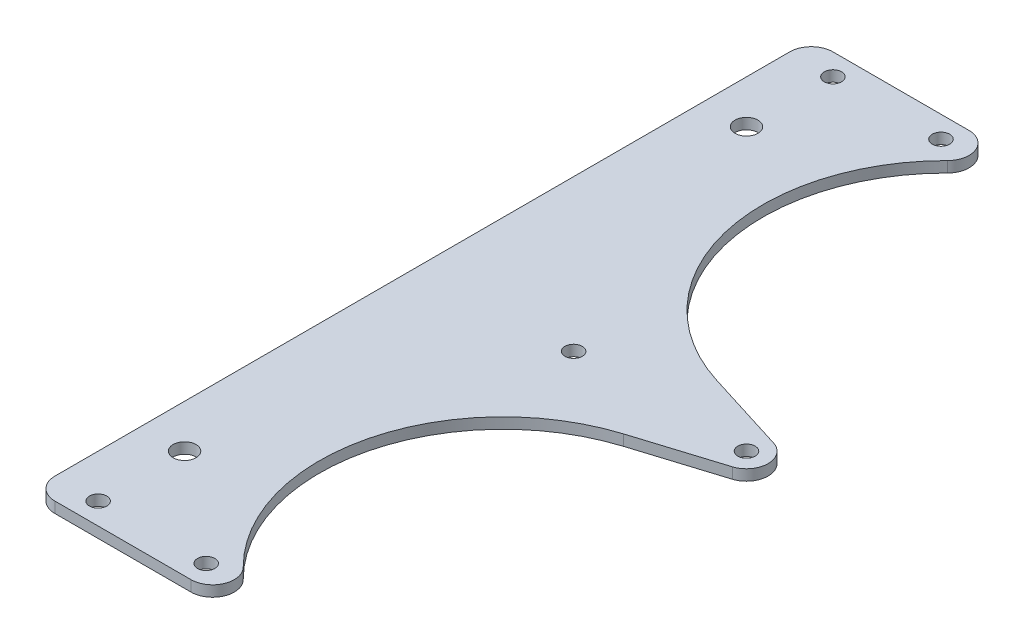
SolidWorks part; units mm, degrees
ref_plane "Front Plane" through (0, 0, 0) normal (0, 0, 1) x (1, 0, 0)
ref_plane "Top Plane" through (0, 0, 0) normal (0, 1, 0) x (1, 0, 0)
ref_plane "Right Plane" through (0, 0, 0) normal (1, 0, 0) x (0, 0, -1)
sketch "Sketch1" plane through (0, 0, 0) normal (0, 1, 0) x (1, 0, 0)
  line L0 (0, 6.35) -> (0, 222.25)
  line L1 (6.35, 228.6) -> (46.3487, 228.6)
  line L2 (6.35, 0) -> (46.3487, 0)
  line L3 (72.7953, 127.9727) -> (97.1447, 120.3608)
  line L4 (97.1447, 108.2392) -> (72.7953, 100.6273)
  arc A0 (72.7953, 100.6273) -> (50.8278, 10.8511) centre (88.9, 49.1109) ccw
  arc A1 (50.8278, 217.7489) -> (72.7953, 127.9727) centre (88.9, 179.4891) ccw
  arc A2 (0, 6.35) -> (6.35, 0) centre (6.35, 6.35) ccw
  arc A3 (0, 222.25) -> (6.35, 228.6) centre (6.35, 222.25) cw
  arc A4 (97.1447, 120.3608) -> (97.1447, 108.2392) centre (95.25, 114.3) cw
  arc A5 (46.3487, 0) -> (50.8278, 10.8511) centre (46.3487, 6.35) ccw
  arc A6 (50.8278, 217.7489) -> (46.3487, 228.6) centre (46.3487, 222.25) ccw
  point P9 (44.45, 114.3)
  point P13 (0, 0)
  point P16 (0, 228.6)
  point P17 (95.25, 114.3)
  point P18 (0, 114.3)
  dimension "D2" = 107.95
  dimension "D4" = 6.35
  dimension "D7" = 130.3782
  dimension "D8" = 6.35
  dimension "D9" = 6.35
  dimension "D1" = 88.9
  dimension "D3" = 228.6
  dimension "D5" = 44.45
  dimension "D6" = 50.8
extrude "Boss-Extrude1" add sketch "Sketch1" along normal blind 3.175
hole_wizard "#7 (0.201) Diameter Hole1" positions "Sketch2" profile "Sketch3" hole size "#7" standard "ANSI Inch"
sketch "Sketch2" plane through (0, 3.175, 0) normal (0, 1, 0) x (1, 0, 0)
  line L0 (46.3487, 228.6) -> (6.35, 228.6) construction
  line L1 (0, 222.25) -> (0, 6.35) construction
  line L2 (6.35, 0) -> (46.3487, 0) construction
  point P0 (95.25, 114.3)
  point P2 (44.45, 114.3)
  point P4 (12.7, 222.25)
  point P6 (12.7, 6.35)
  point P8 (12.7, 31.75)
  point P10 (12.7, 196.85)
  point P14 (44.45, 6.35)
  point P18 (44.45, 222.25)
  dimension "D1" = 6.35
  dimension "D2" = 12.7
  dimension "D3" = 114.3
  dimension "D4" = 44.45
  dimension "D5" = 50.8
  dimension "D6" = 31.75
  dimension "D8" = 25.4
  dimension "D9" = 6.35
  dimension "D10" = 25.4
sketch "Sketch3" plane through (95.25, 3.175, -114.3) normal (1, 0, 0) x (0, 0, 1)
  line L0 (0, 0) -> (0, 3.175)
  line L1 (0, 3.175) -> (2.5527, 3.175)
  line L2 (2.5527, 3.175) -> (2.5527, 0)
  line L5 (2.5527, 0) -> (0, 0)
  line L11 (0, -6.35) -> (0, 107.95) construction
  dimension "Thru Hole Dia." = 5.1054
  dimension "Thru Hole Depth" = 3.175
hole_wizard "17/64 (0.26563) Diameter Hole1" positions "Sketch4" profile "Sketch5" hole size "17/64" standard "ANSI Inch"
sketch "Sketch4" plane through (0, 3.175, 0) normal (0, 1, 0) x (1, 0, 0)
  point P0 (12.7, 196.85)
  point P3 (12.7, 31.75)
sketch "Sketch5" plane through (12.7, 3.175, -196.85) normal (1, 0, 0) x (0, 0, 1)
  line L0 (0, 0) -> (0, 3.175)
  line L1 (0, 3.175) -> (3.3735, 3.175)
  line L2 (3.3735, 3.175) -> (3.3735, 0)
  line L5 (3.3735, 0) -> (0, 0)
  line L11 (0, -6.35) -> (0, 107.95) construction
  dimension "Thru Hole Dia." = 6.747
  dimension "Thru Hole Depth" = 3.175
